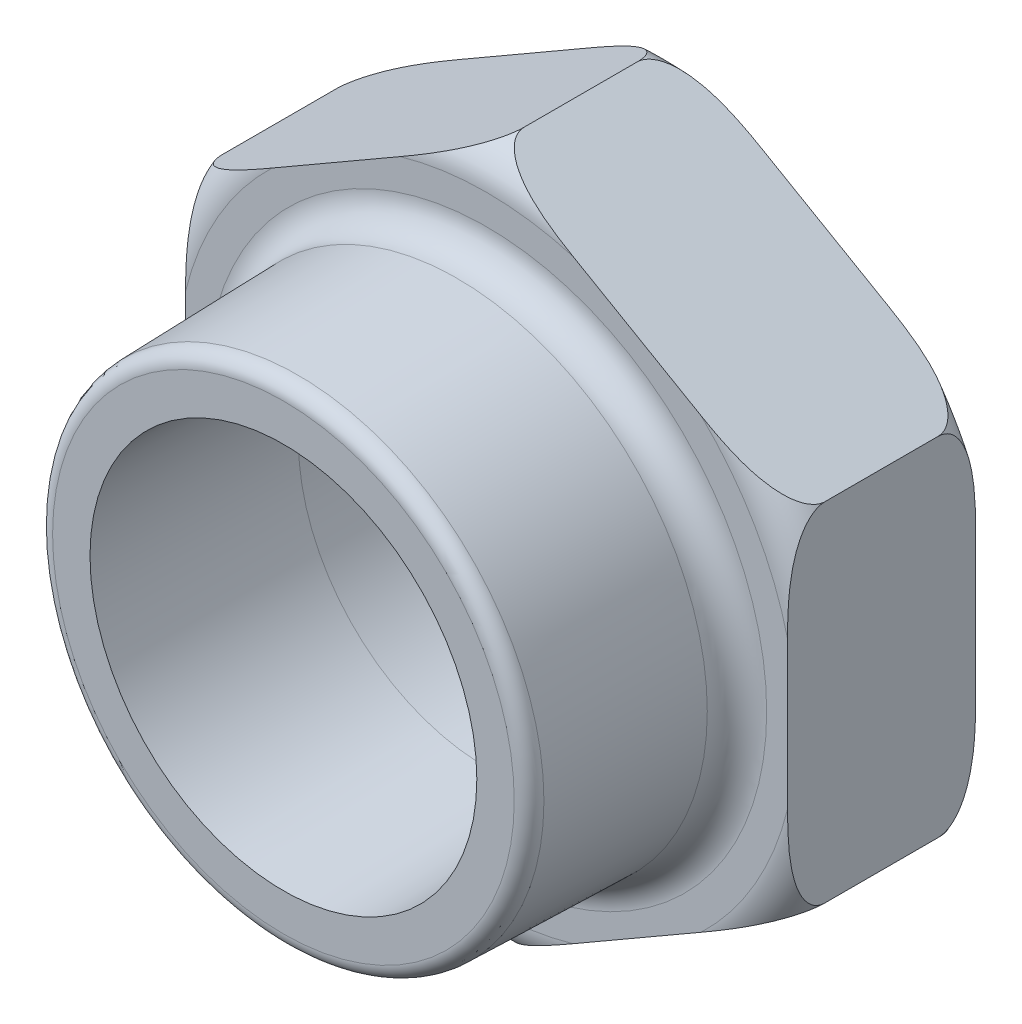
SolidWorks part; units mm, degrees
ref_plane "Face" through (0, 0, 0) normal (0, 0, 1) x (1, 0, 0)
ref_plane "Gauche" through (0, 0, 0) normal (0, 1, 0) x (1, 0, 0)
ref_plane "Dessus" through (0, 0, 0) normal (1, 0, 0) x (0, 0, -1)
sketch "Esquisse1" plane through (0, 0, 0) normal (0, 0, 1) x (1, 0, 0)
  line L0 (0, 0) -> (-49.3312, 0) construction
  line L1 (0, 0) -> (0, -43.0886) construction
  line L2 (-4, 2.3094) -> (-4, -2.3094)
  line L3 (4, 2.3094) -> (4, -2.3094)
  line L4 (-4, -2.3094) -> (0, -4.6188)
  line L5 (4, -2.3094) -> (0, -4.6188)
  line L7 (-4, 2.3094) -> (0, 4.6188)
  line L9 (4, 2.3094) -> (0, 4.6188)
  point P14 (-4, 0)
  point P17 (4, 0)
  dimension "D1" = 8
  dimension "A" = 8
  dimension "D3" = 8
  dimension "D4" = 30
extrude "Tete" add sketch "Esquisse1" along normal blind 2.5
sketch "Esquisse2" plane through (0, 0, 0) normal (1, 0, 0) x (0, 0, -1)
  line L0 (0, 0) -> (-68.4114, 0) construction
  line L1 (0, -2.3094) -> (0, -4.6188) construction
  line L2 (-2.5, -4.6188) -> (0, -4.6188) construction
  line L3 (-0.5, -4.6188) -> (-0.5, -14.6188)
  line L4 (8.7711, -14.6188) -> (-0.5, -14.6188)
  line L5 (0, -4.1188) -> (8.7711, -4.1188)
  line L7 (8.7711, -4.1188) -> (8.7711, -14.6188)
  arc A0 (-0.5, -4.6188) -> (0, -4.1188) centre (-0.5, -4.1188) ccw
  dimension "R" = 0.5
  dimension "D2" = 8.7711
  dimension "D3" = 10
revolve "Rayon de tete" cut sketch "Esquisse2" angle 360 about L0
ref_plane "Plan1" through (0, 0, 1.25) normal (0, 0, 1) x (1, 0, 0)
mirror "Symétrie1" about plane through (0, 0, 1.25) normal (0, 0, 1) of "Rayon de tete"
sketch "Esquisse3" plane through (0, 0, 0) normal (0, 0, -1) x (-1, 0, 0)
  circle A0 centre (0, 0) radius 2.5
  dimension "D" = 5
extrude "Enlèv. de mat.-Extru.1" cut sketch "Esquisse3" against normal through all
sketch "Esquisse4" plane through (0, 0, 2.5) normal (0, 0, 1) x (1, 0, 0)
  circle A0 centre (0, 0) radius 3.3333
  circle A1 centre (0, 0) radius 2.5 construction
  circle A2 centre (0, 0) radius 2.5
  dimension "Dn" = 6.6667
extrude "Boss.-Extru.1" add sketch "Esquisse4" along normal blind 2.7 draft 1.5
fillet "Congé1" radius 0.4 1 edges at (3.3333, 0, 2.5)
fillet "Congé3" radius 0.2 1 edges at (3.2626, 0, 5.2)
equation "\"D1@Esquisse1\" = \"A@Esquisse1\""
equation "\"D3@Esquisse1\" = \"A@Esquisse1\""
equation "\"D1@Plan1\" = \"B@Tete\"/2"
equation "\"Dn@Esquisse4\" = \"D@Esquisse3\"+ \"D@Esquisse3\"/3"
equation "\"Ra@Congé1\" = \"R@Esquisse2\"*0.8"
equation "\"D1@Congé3\" = \"Ra@Congé1\"/2"
